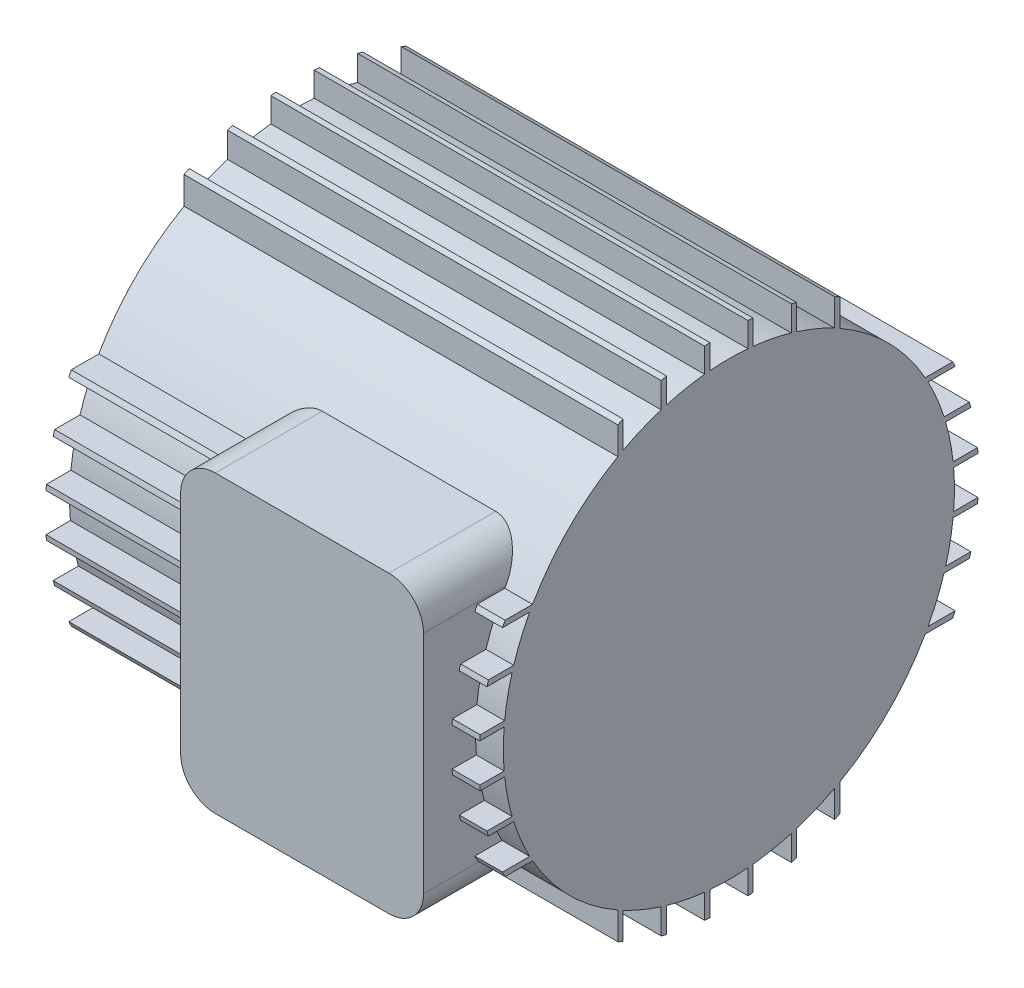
SolidWorks part; units mm, degrees
ref_plane "Face" through (0, 0, 0) normal (0, 0, 1) x (1, 0, 0)
ref_plane "Dessus" through (0, 0, 0) normal (0, 1, 0) x (1, 0, 0)
ref_plane "Droite" through (0, 0, 0) normal (1, 0, 0) x (0, 0, -1)
sketch "Esquisse3" plane through (0, 0, 0) normal (1, 0, 0) x (0, 0, -1)
  circle A0 centre (0, 0) radius 65
  dimension "D1" = 130
extrude "Base-Extrusion" add sketch "Esquisse3" against normal blind 125
sketch "Esquisse4" plane through (0, 0, 0) normal (1, 0, 0) x (0, 0, -1)
  line L0 (0, 0) -> (26.4298, 0) construction
  line L1 (62.458, 18) -> (69.7137, 18)
  line L3 (56.5774, -32) -> (64.4981, -32)
  line L4 (57.3999, -30.5) -> (65.2208, -30.5)
  line L5 (62.006, -19.5) -> (69.3091, -19.5)
  line L6 (64.622, -7) -> (71.6589, -7)
  line L7 (64.7669, 5.5) -> (71.7896, 5.5)
  line L8 (64.622, 7) -> (71.6589, 7)
  line L9 (62.006, 19.5) -> (69.3091, 19.5)
  line L10 (57.3999, 30.5) -> (65.2208, 30.5)
  line L11 (56.5774, 32) -> (64.4981, 32)
  line L12 (64.7669, -5.5) -> (71.7896, -5.5)
  line L13 (62.458, -18) -> (69.7137, -18)
  arc A0 (64.4981, -32) -> (65.2208, -30.5) centre (0, 0) ccw
  circle A1 centre (0, 0) radius 65 construction
  arc A2 (56.5774, -32) -> (57.3999, -30.5) centre (0, 0) ccw
  arc A3 (69.3091, -19.5) -> (69.7137, -18) centre (0, 0) ccw
  arc A4 (71.6589, -7) -> (71.7896, -5.5) centre (0, 0) ccw
  arc A5 (71.7896, 5.5) -> (71.6589, 7) centre (0, 0) ccw
  arc A6 (69.7137, 18) -> (69.3091, 19.5) centre (0, 0) ccw
  arc A7 (65.2208, 30.5) -> (64.4981, 32) centre (0, 0) ccw
  arc A8 (62.006, -19.5) -> (62.458, -18) centre (0, 0) ccw
  arc A9 (64.622, -7) -> (64.7669, -5.5) centre (0, 0) ccw
  arc A10 (64.7669, 5.5) -> (64.622, 7) centre (0, 0) ccw
  arc A11 (62.458, 18) -> (62.006, 19.5) centre (0, 0) ccw
  arc A12 (57.3999, 30.5) -> (56.5774, 32) centre (0, 0) ccw
  dimension "D1" = 1.5
  dimension "D2" = 11
  dimension "D3" = 11
  dimension "D4" = 1.5
  dimension "D5" = 1.5
  dimension "D6" = 11
  dimension "D7" = 1.5
  dimension "D8" = 1.5
  dimension "D9" = 11
  dimension "D10" = 72
extrude "Boss.-Extru.4" add sketch "Esquisse4" against normal up to surface (125 mm away)
pattern_circular "Répétition circulaire1" count 4 over 360
sketch "Esquisse5" plane through (0, 0, 0) normal (0, 0, 1) x (1, 0, 0)
  line L0 (-46.1099, 0) -> (9.7817, 0) construction
  line L1 (-125, 0) -> (0, 0) construction
  line L2 (-43, 0) -> (-43, 85) construction
  line L3 (-78, 42.5) -> (-8, 42.5)
  line L4 (-8, 42.5) -> (-8, -42.5)
  line L5 (-78, 42.5) -> (-78, -42.5)
  line L6 (-78, -42.5) -> (-8, -42.5)
  point P9 (-43, -42.5)
  point P10 (-43, 42.5)
  point P12 (-78, 0)
  point P13 (-8, 0)
  dimension "D1" = 70
  dimension "D2" = 85
  dimension "D3" = 43
extrude "boite de raccordement" add sketch "Esquisse5" along normal blind 80
fillet "Congé1" radius 10
